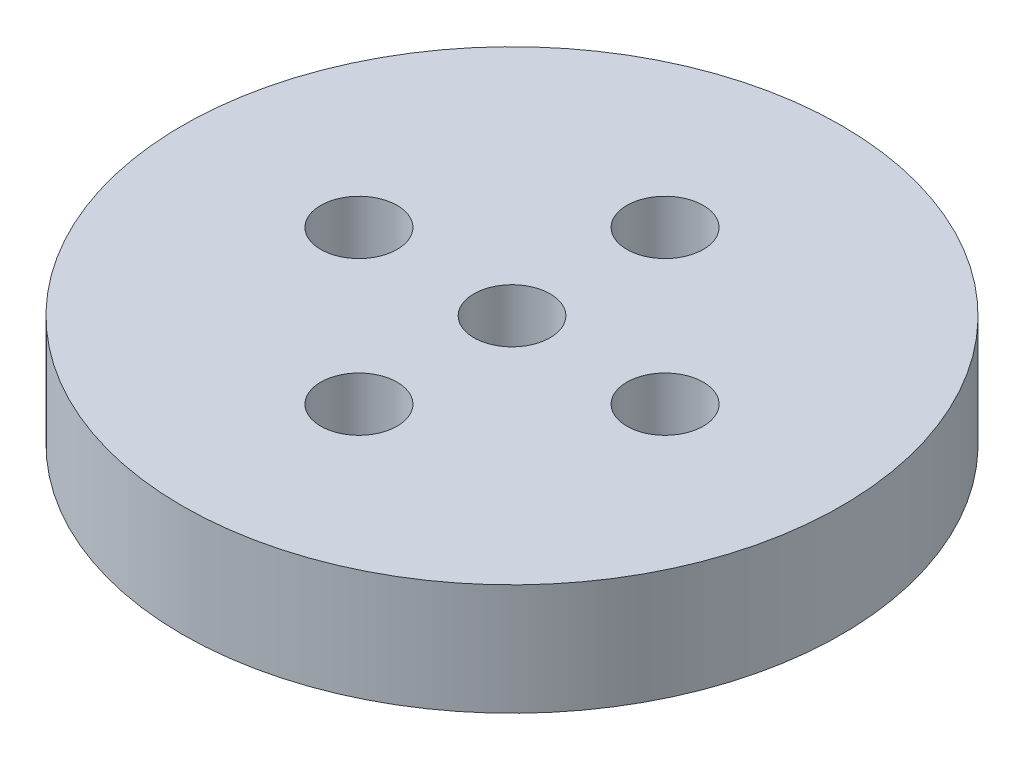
SolidWorks part; units mm, degrees
ref_plane "Front Plane" through (0, 0, 0) normal (0, 0, 1) x (1, 0, 0)
ref_plane "Top Plane" through (0, 0, 0) normal (0, 1, 0) x (1, 0, 0)
ref_plane "Right Plane" through (0, 0, 0) normal (1, 0, 0) x (0, 0, -1)
sketch "Sketch1" plane through (0, 0, 0) normal (0, 1, 0) x (1, 0, 0)
  line L0 (0, 0) -> (0, 7.4317) construction
  line L1 (7.4317, 0) -> (0, 0) construction
  circle A0 centre (0, 0) radius 16
  circle A1 centre (0, 0) radius 1.85
  circle A2 centre (0, 7.4317) radius 1.855
  circle A3 centre (7.4317, 0) radius 1.855
  circle A4 centre (0, -7.4317) radius 1.855
  circle A5 centre (-7.4317, 0) radius 1.855
  point P15 (0, 0)
  dimension "D1" = 32
  dimension "D2" = 3.7
  dimension "D4" = 3.71
  dimension "D3" = 10.51
  dimension "D5" = 4
extrude "Boss-Extrude1" add sketch "Sketch1" along normal blind 5.4
